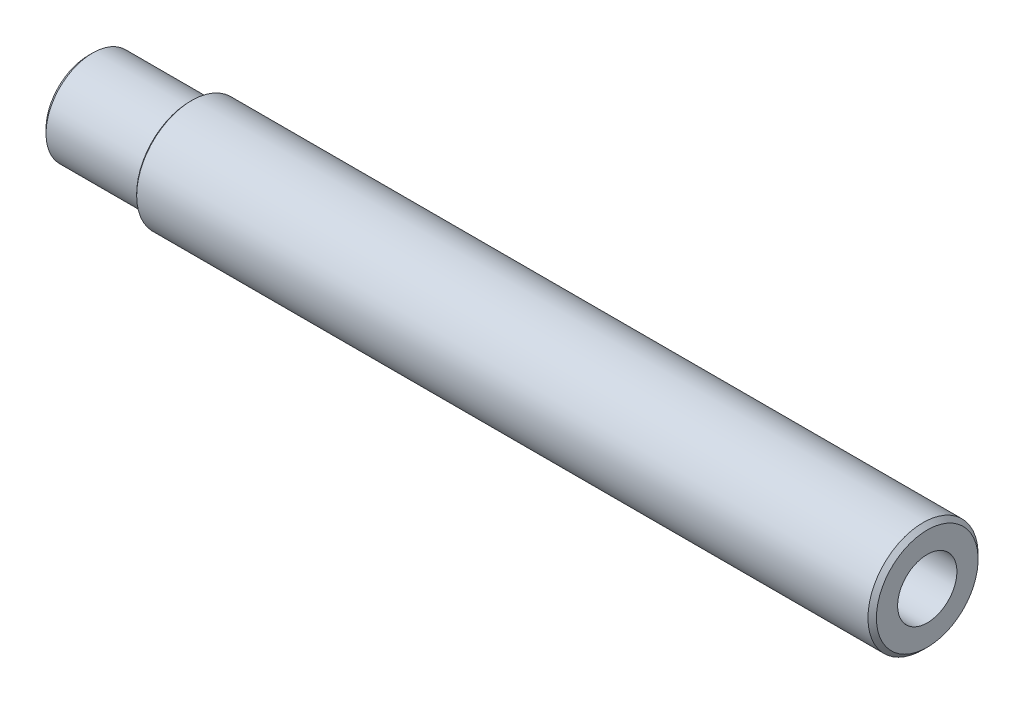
SolidWorks part; units mm, degrees
ref_plane "Front X-Y" through (0, 0, 0) normal (0, 0, 1) x (1, 0, 0)
ref_plane "Top X-Z" through (0, 0, 0) normal (0, 1, 0) x (1, 0, 0)
ref_plane "Right Y-Z" through (0, 0, 0) normal (1, 0, 0) x (0, 0, -1)
ref_plane "Plane1" through (0, 0, 0) normal (0, 0, 1) x (1, 0, 0)
sketch "Sketch1" plane through (0, 0, 0) normal (0, 0, 1) x (1, 0, 0)
  line L0 (-12, 0) -> (-12, 5)
  line L1 (-12, 5) -> (-11.5, 5.5)
  line L2 (-11.5, 5.5) -> (-0.3, 5.5)
  line L3 (0, 5.8) -> (0, 6.3)
  line L4 (0, 6.3) -> (0.2, 6.5)
  line L5 (0.2, 6.5) -> (86.5, 6.5)
  line L6 (86.5, 6.5) -> (87, 6)
  line L7 (87, 6) -> (87, 0)
  line L8 (87, 0) -> (-12, 0)
  line L9 (87, 0) -> (-12, 0) construction
  arc A0 (-0.3, 5.5) -> (0, 5.8) centre (-0.3, 5.8) ccw
revolve "Revolve1" add sketch "Sketch1" angle 360 about L9
ref_plane "Plane2" through (0, 0, 0) normal (0, 0, 1) x (1, 0, 0)
sketch "Sketch2" plane through (0, 0, 0) normal (0, 0, 1) x (1, 0, 0)
  line L0 (-12, 0) -> (-12, 3.5)
  line L1 (-12, 3.5) -> (87, 3.5)
  line L2 (87, 3.5) -> (87, 0)
  line L3 (87, 0) -> (-12, 0)
  line L4 (87, 0) -> (-12, 0) construction
revolve "Cut-Revolve1" cut sketch "Sketch2" angle 360 about L4
